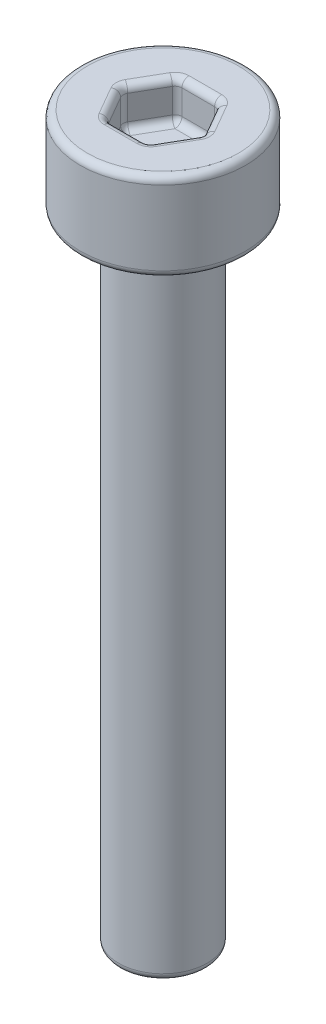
SolidWorks part; units mm, degrees
ref_plane "前视基准面" through (0, 0, 0) normal (0, 0, 1) x (1, 0, 0)
ref_plane "上视基准面" through (0, 0, 0) normal (0, 1, 0) x (1, 0, 0)
ref_plane "右视基准面" through (0, 0, 0) normal (1, 0, 0) x (0, 0, -1)
sketch "Sketch1" plane through (0, 0, 0) normal (0, 1, 0) x (1, 0, 0)
  circle A0 centre (0, 0) radius 1.25
  dimension "螺丝直径" = 2.5
extrude "Boss-Extrude1" add sketch "Sketch1" against normal blind 18
sketch "Sketch2" plane through (0, 0, 0) normal (0, 1, 0) x (1, 0, 0)
  circle A0 centre (0, 0) radius 2.34
  dimension "头部直径" = 4.68
extrude "Boss-Extrude2" add sketch "Sketch2" along normal blind 2.5
sketch "Sketch3" plane through (0, 2.5, 0) normal (0, 1, 0) x (1, 0, 0)
  line L1 (1.1547, 0) -> (0.5774, 1)
  line L2 (0.5774, 1) -> (-0.5774, 1)
  line L3 (-0.5774, 1) -> (-1.1547, 0)
  line L4 (-1.1547, 0) -> (-0.5774, -1)
  line L5 (-0.5774, -1) -> (0.5774, -1)
  line L6 (0.5774, -1) -> (1.1547, 0)
  circle A0 centre (0, 0) radius 1 construction
  dimension "内六角对边" = 2
extrude "Cut-Extrude1" cut sketch "Sketch3" against normal blind 1.1
fillet "Fillet1" radius 0.2 21 edges at (-0.866, 1.4, 0.5) (-0.866, 2.5, 0.5) (-0.5774, 1.95, 1) (0, 1.4, 1) (0, 2.5, 1) (0.5774, 1.95, 1) (0.866, 1.4, 0.5) (0.866, 2.5, 0.5) (1.1547, 1.95, 0) (0.866, 1.4, -0.5) (0.866, 2.5, -0.5) (-0.866, 1.4, -0.5) (-1.1547, 1.95, 0) (-0.866, 2.5, -0.5) (0.5774, 1.95, -1) (0, 1.4, -1) (-0.5774, 1.95, -1) (0, 2.5, -1) (0, -18, 1.25) (0, 0, 2.34) (0, 2.5, 2.34)
other "Freeze***"
